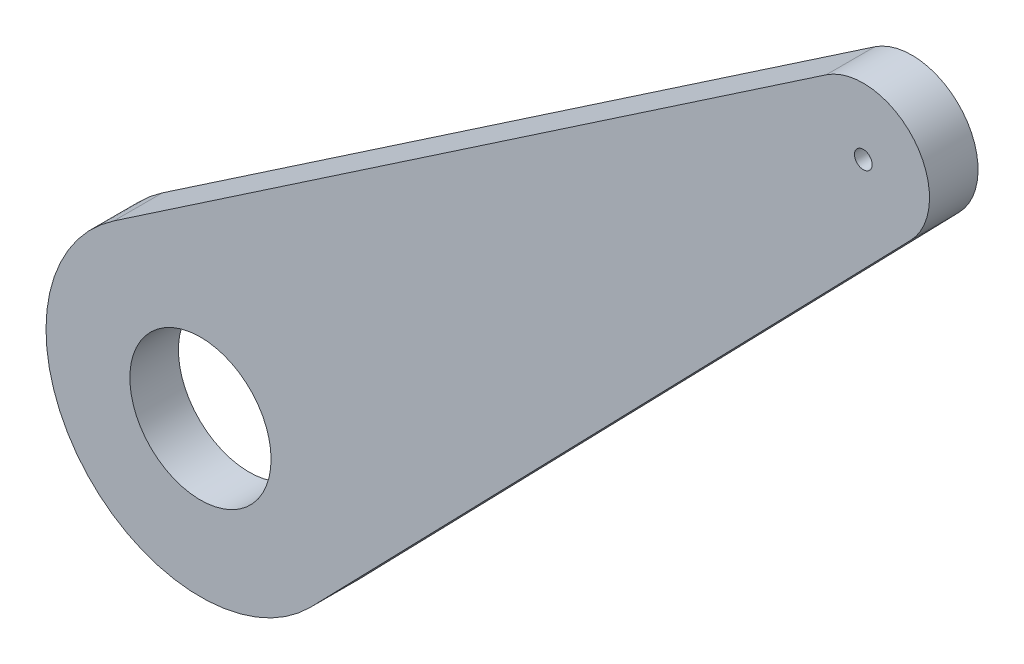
SolidWorks part; units mm, degrees
ref_plane "Plan de face" through (0, 0, 0) normal (0, 0, 1) x (1, 0, 0)
ref_plane "Plan de dessus" through (0, 0, 0) normal (0, 1, 0) x (1, 0, 0)
ref_plane "Plan de droite" through (0, 0, 0) normal (1, 0, 0) x (0, 0, -1)
sketch "Esquisse1" plane through (0, 0, 0) normal (0, 0, 1) x (1, 0, 0)
  line L0 (75.0964, 62.9645) -> (0, 0) construction
  line L1 (80.4764, 57.739) -> (12.5533, -12.1928)
  line L2 (70.8893, 69.1734) -> (-9.8166, 14.4874)
  line L3 (-9.8166, 14.4874) -> (12.5533, -12.1928) construction
  line L4 (70.8893, 69.1734) -> (80.4764, 57.739) construction
  circle A0 centre (0, 0) radius 17.5
  circle A1 centre (75.0964, 62.9645) radius 7.5
  circle A2 centre (0, 0) radius 8
  circle A3 centre (75.0964, 62.9645) radius 1
  dimension "D1" = 15
  dimension "D2" = 35
  dimension "D4" = 16
  dimension "D3" = 98
extrude "Boss.-Extru.1" add sketch "Esquisse1" along normal blind 5.5 contours A1 L2 A0 L1 | A0 A2 | A1 A3
